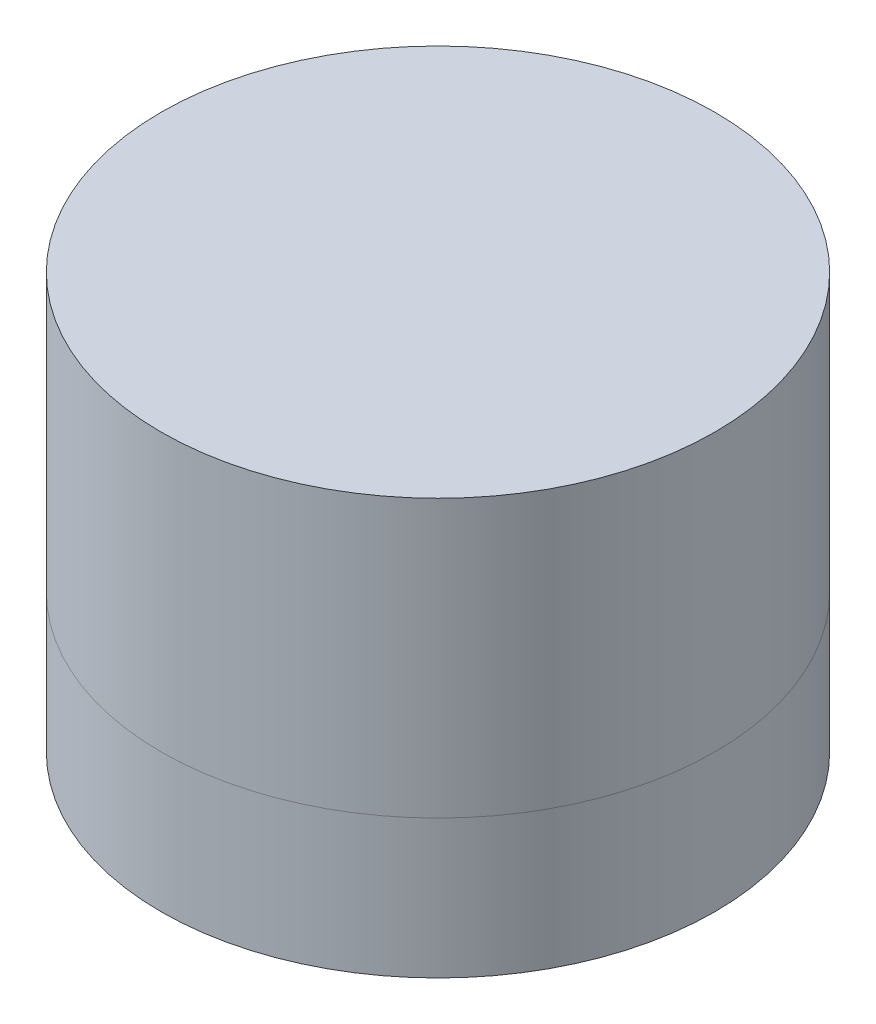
SolidWorks part; units mm, degrees
ref_plane "Front Plane" through (0, 0, 0) normal (0, 0, 1) x (1, 0, 0)
ref_plane "Top Plane" through (0, 0, 0) normal (0, 1, 0) x (1, 0, 0)
ref_plane "Right Plane" through (0, 0, 0) normal (1, 0, 0) x (0, 0, -1)
sketch "Sketch1" plane through (0, 0, 0) normal (0, 0, 1) x (1, 0, 0)
  line L0 (14.8295, 3) -> (14.8278, 0)
  line L1 (14.8278, 0) -> (19.8278, 0)
  line L2 (4.8278, 0) -> (4.8278, 13) construction
  line L4 (18.8278, 3) -> (17.8278, 3)
  line L6 (4.8278, 10.13) -> (4.8278, 13)
  line L8 (18.8278, 3) -> (19.8278, 0)
  line L12 (7.6978, 2.87) -> (14.8278, 2.87) construction
  line L13 (14.8278, 2.87) -> (14.8734, 2.87) construction
  line L14 (14.8734, 2.87) -> (14.8734, 2.87) construction
  line L15 (14.8734, 2.87) -> (14.8734, 2.87) construction
  line L16 (7.6978, 2.87) -> (7.6978, 9.7333) construction
  line L17 (4.8278, 0) -> (14.8278, 0) construction
  arc A0 (4.8278, 13) -> (17.8278, 3) centre (4.8278, -0.45) cw
  arc A1 (4.8278, 10.13) -> (14.8295, 3) centre (4.8278, -0.45) cw
  arc A2 (7.6978, 9.7333) -> (14.8734, 2.87) centre (4.8278, -0.45) cw construction
revolve "Revolve1" add sketch "Sketch1" angle 360 about L6
scale "Scale1" scale about centroid uniform scaling yes scale factor 1
other "Parting Line1"
other "Parting Surface1" parameters "D1"=11.1
sketch "Sketch2" plane through (0, 0, 0) normal (0, 1, 0) x (1, 0, 0)
  line L0 (4.8278, 0) -> (14.8295, 0) construction
  line L1 (4.8278, 0) -> (17.8278, 0) construction
  circle A0 centre (4.8278, 0) radius 20
  dimension "D1" = 40
other "Tooling Split1" parameters "D1"=10, "D2"=20, "D3"=3
